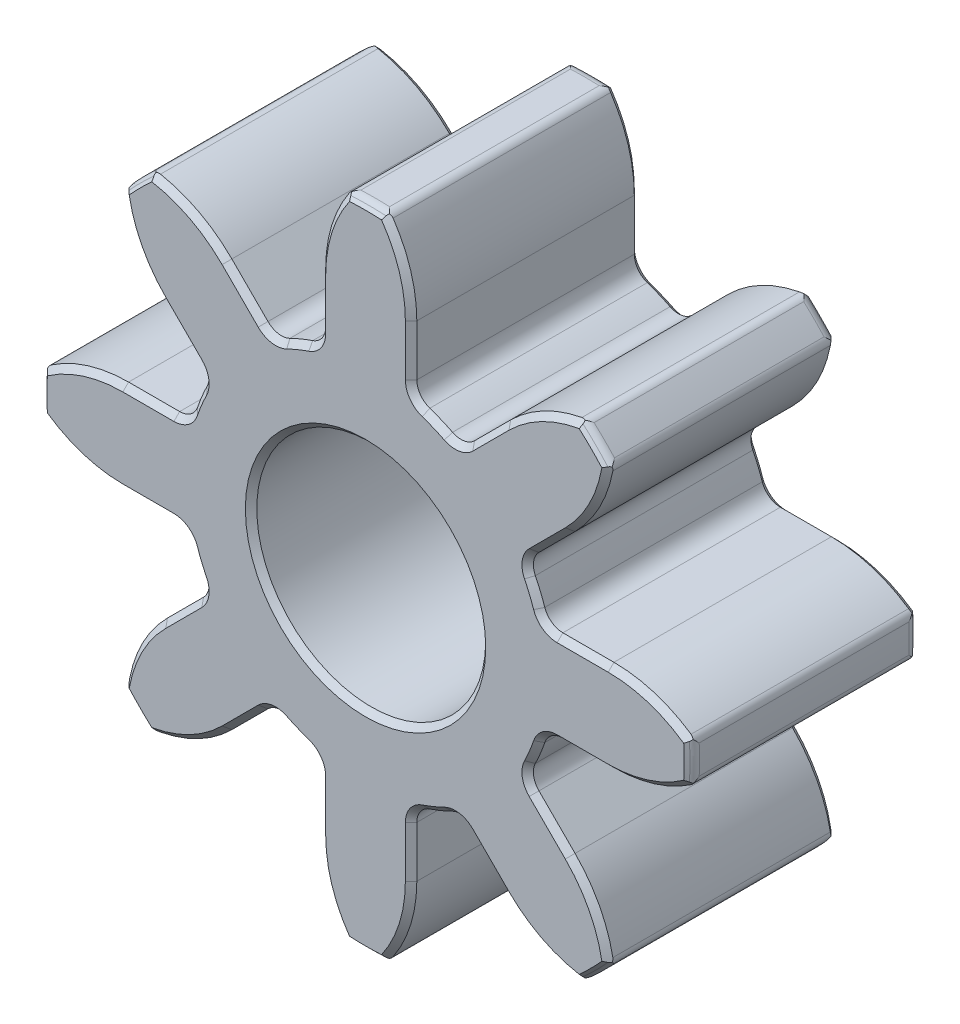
SolidWorks part; units mm, degrees
ref_plane "Спереди" through (0, 0, 0) normal (0, 0, 1) x (1, 0, 0)
ref_plane "Сверху" through (0, 0, 0) normal (0, 1, 0) x (1, 0, 0)
ref_plane "Справа" through (0, 0, 0) normal (1, 0, 0) x (0, 0, -1)
sketch "Эскиз1" plane through (0, 0, 0) normal (0, 0, 1) x (1, 0, 0)
  line L0 (0, 0) -> (0, 8.5) construction
  line L1 (-1.1942, 6.3602) -> (-1.1942, 5.0219)
  line L2 (1.1942, 6.3602) -> (1.1942, 5.0219)
  line L3 (3.6529, 5.3417) -> (2.7067, 4.3954)
  line L4 (5.3417, 3.6529) -> (4.3954, 2.7067)
  line L5 (6.3602, 1.1942) -> (5.0219, 1.1942)
  line L6 (6.3602, -1.1942) -> (5.0219, -1.1942)
  line L7 (5.3417, -3.6529) -> (4.3954, -2.7067)
  line L8 (3.6529, -5.3417) -> (2.7067, -4.3954)
  line L9 (1.1942, -6.3602) -> (1.1942, -5.0219)
  line L10 (-1.1942, -6.3602) -> (-1.1942, -5.0219)
  line L11 (-3.6529, -5.3417) -> (-2.7067, -4.3954)
  line L12 (-5.3417, -3.6529) -> (-4.3954, -2.7067)
  line L13 (-6.3602, -1.1942) -> (-5.0219, -1.1942)
  line L14 (-6.3602, 1.1942) -> (-5.0219, 1.1942)
  line L15 (-5.3417, 3.6529) -> (-4.3954, 2.7067)
  line L16 (-3.6529, 5.3417) -> (-2.7067, 4.3954)
  arc A0 (0.5, 8.4853) -> (-0.5, 8.4853) centre (0, 0) ccw
  circle A1 centre (0, 0) radius 6.8 construction
  arc A2 (-1.5343, 4.5482) -> (-1.8369, 4.4346) centre (0, 0) ccw
  circle A3 centre (0, 0) radius 3
  arc A4 (-0.5, 8.4853) -> (-1.1942, 6.3602) centre (2.4058, 6.3602) ccw
  arc A5 (1.5343, 4.5482) -> (1.8369, 4.4346) centre (0, 0) cw
  arc A6 (1.1942, 5.0219) -> (1.5343, 4.5482) centre (1.6942, 5.0219) ccw
  arc A7 (0.5, 8.4853) -> (1.1942, 6.3602) centre (-2.4058, 6.3602) cw
  arc A8 (2.1311, 4.301) -> (1.8369, 4.4346) centre (0, 0) ccw
  arc A9 (2.7067, 4.3954) -> (2.1311, 4.301) centre (2.3531, 4.749) cw
  arc A10 (5.6464, 6.3536) -> (3.6529, 5.3417) centre (6.1985, 2.7961) ccw
  arc A11 (6.3536, 5.6464) -> (5.6464, 6.3536) centre (0, 0) ccw
  arc A12 (6.3536, 5.6464) -> (5.3417, 3.6529) centre (2.7961, 6.1985) cw
  arc A13 (4.3954, 2.7067) -> (4.301, 2.1311) centre (4.749, 2.3531) ccw
  arc A14 (4.301, 2.1311) -> (4.4346, 1.8369) centre (0, 0) cw
  arc A15 (4.5482, 1.5343) -> (4.4346, 1.8369) centre (0, 0) ccw
  arc A16 (5.0219, 1.1942) -> (4.5482, 1.5343) centre (5.0219, 1.6942) cw
  arc A17 (8.4853, 0.5) -> (6.3602, 1.1942) centre (6.3602, -2.4058) ccw
  arc A18 (8.4853, -0.5) -> (8.4853, 0.5) centre (0, 0) ccw
  arc A19 (8.4853, -0.5) -> (6.3602, -1.1942) centre (6.3602, 2.4058) cw
  arc A20 (5.0219, -1.1942) -> (4.5482, -1.5343) centre (5.0219, -1.6942) ccw
  arc A21 (4.5482, -1.5343) -> (4.4346, -1.8369) centre (0, 0) cw
  arc A22 (4.301, -2.1311) -> (4.4346, -1.8369) centre (0, 0) ccw
  arc A23 (4.3954, -2.7067) -> (4.301, -2.1311) centre (4.749, -2.3531) cw
  arc A24 (6.3536, -5.6464) -> (5.3417, -3.6529) centre (2.7961, -6.1985) ccw
  arc A25 (5.6464, -6.3536) -> (6.3536, -5.6464) centre (0, 0) ccw
  arc A26 (5.6464, -6.3536) -> (3.6529, -5.3417) centre (6.1985, -2.7961) cw
  arc A27 (2.7067, -4.3954) -> (2.1311, -4.301) centre (2.3531, -4.749) ccw
  arc A28 (2.1311, -4.301) -> (1.8369, -4.4346) centre (0, 0) cw
  arc A29 (1.5343, -4.5482) -> (1.8369, -4.4346) centre (0, 0) ccw
  arc A30 (1.1942, -5.0219) -> (1.5343, -4.5482) centre (1.6942, -5.0219) cw
  arc A31 (0.5, -8.4853) -> (1.1942, -6.3602) centre (-2.4058, -6.3602) ccw
  arc A32 (-0.5, -8.4853) -> (0.5, -8.4853) centre (0, 0) ccw
  arc A33 (-0.5, -8.4853) -> (-1.1942, -6.3602) centre (2.4058, -6.3602) cw
  arc A34 (-1.1942, -5.0219) -> (-1.5343, -4.5482) centre (-1.6942, -5.0219) ccw
  arc A35 (-1.5343, -4.5482) -> (-1.8369, -4.4346) centre (0, 0) cw
  arc A36 (-2.1311, -4.301) -> (-1.8369, -4.4346) centre (0, 0) ccw
  arc A37 (-2.7067, -4.3954) -> (-2.1311, -4.301) centre (-2.3531, -4.749) cw
  arc A38 (-5.6464, -6.3536) -> (-3.6529, -5.3417) centre (-6.1985, -2.7961) ccw
  arc A39 (-6.3536, -5.6464) -> (-5.6464, -6.3536) centre (0, 0) ccw
  arc A40 (-6.3536, -5.6464) -> (-5.3417, -3.6529) centre (-2.7961, -6.1985) cw
  arc A41 (-4.3954, -2.7067) -> (-4.301, -2.1311) centre (-4.749, -2.3531) ccw
  arc A42 (-4.301, -2.1311) -> (-4.4346, -1.8369) centre (0, 0) cw
  arc A43 (-4.5482, -1.5343) -> (-4.4346, -1.8369) centre (0, 0) ccw
  arc A44 (-5.0219, -1.1942) -> (-4.5482, -1.5343) centre (-5.0219, -1.6942) cw
  arc A45 (-8.4853, -0.5) -> (-6.3602, -1.1942) centre (-6.3602, 2.4058) ccw
  arc A46 (-8.4853, 0.5) -> (-8.4853, -0.5) centre (0, 0) ccw
  arc A47 (-8.4853, 0.5) -> (-6.3602, 1.1942) centre (-6.3602, -2.4058) cw
  arc A48 (-5.0219, 1.1942) -> (-4.5482, 1.5343) centre (-5.0219, 1.6942) ccw
  arc A49 (-1.1942, 5.0219) -> (-1.5343, 4.5482) centre (-1.6942, 5.0219) cw
  arc A50 (-4.5482, 1.5343) -> (-4.4346, 1.8369) centre (0, 0) cw
  arc A51 (-4.301, 2.1311) -> (-4.4346, 1.8369) centre (0, 0) ccw
  arc A52 (-4.3954, 2.7067) -> (-4.301, 2.1311) centre (-4.749, 2.3531) cw
  arc A53 (-6.3536, 5.6464) -> (-5.3417, 3.6529) centre (-2.7961, 6.1985) ccw
  arc A54 (-5.6464, 6.3536) -> (-6.3536, 5.6464) centre (0, 0) ccw
  arc A55 (-5.6464, 6.3536) -> (-3.6529, 5.3417) centre (-6.1985, 2.7961) cw
  arc A56 (-2.7067, 4.3954) -> (-2.1311, 4.301) centre (-2.3531, 4.749) ccw
  arc A57 (-2.1311, 4.301) -> (-1.8369, 4.4346) centre (0, 0) cw
  dimension "D1" = 17
  dimension "D2" = 6
  dimension "D3" = 9.6
  dimension "D4" = 13.6
  dimension "D6" = 7.2
  dimension "D8" = 8
  dimension "D7" = 0.5
  dimension "D5" = 1
extrude "Бобышка-Вытянуть1" add sketch "Эскиз1" along normal blind 6
chamfer "Фаска1" distance 0.15 angle 45 130 edges at (3, 0, 0) (1.8369, 4.4346, 0) (-1.1942, -5.6911, 0) (-4.8686, -3.1798, 0) (4.2556, -2.4341, 0) (2.4341, -4.2556, 0) (-2.4341, -4.2556, 0) (4.8686, 3.1798, 0) (-5.6911, -1.1942, 0) (0, 8.5, 0) (-1.0162, 7.478, 0) (-1.1942, 5.6911, 0) (-1.288, 4.7303, 0) (-1.8369, 4.4346, 0) (3, 0, 6) (-1.8369, 4.4346, 6) (-1.288, 4.7303, 6) (-1.1942, 5.6911, 6) (-1.0162, 7.478, 6) (0, 8.5, 6) (-5.6911, -1.1942, 6) (4.8686, 3.1798, 6) (-2.4341, -4.2556, 6) (2.4341, -4.2556, 6) (4.2556, -2.4341, 6) (-4.8686, -3.1798, 6) (-1.1942, -5.6911, 6) (1.8369, 4.4346, 6) (-2.4341, 4.2556, 0) (-3.1798, 4.8686, 0) (-4.5692, 6.0063, 0) (-6.0104, 6.0104, 0) (-6.0063, 4.5692, 0) (-4.8686, 3.1798, 0) (-4.2556, 2.4341, 0) (-4.4346, 1.8369, 0) (-4.7303, 1.288, 0) (-5.6911, 1.1942, 0) (-7.478, 1.0162, 0) (-8.5, 0, 0) (-7.478, -1.0162, 0) (-4.7303, -1.288, 0) (-4.4346, -1.8369, 0) (-4.2556, -2.4341, 0) (-6.0063, -4.5692, 0) (-6.0104, -6.0104, 0) (-4.5692, -6.0063, 0) (-3.1798, -4.8686, 0) (-1.8369, -4.4346, 0) (-1.288, -4.7303, 0) (-1.0162, -7.478, 0) (0, -8.5, 0) (1.0162, -7.478, 0) (1.1942, -5.6911, 0) (1.288, -4.7303, 0) (1.8369, -4.4346, 0) (3.1798, -4.8686, 0) (4.5692, -6.0063, 0) (6.0104, -6.0104, 0) (6.0063, -4.5692, 0) (4.8686, -3.1798, 0) (4.4346, -1.8369, 0) (4.7303, -1.288, 0) (5.6911, -1.1942, 0) (7.478, -1.0162, 0) (8.5, 0, 0) (7.478, 1.0162, 0) (5.6911, 1.1942, 0) (4.7303, 1.288, 0) (4.4346, 1.8369, 0) (4.2556, 2.4341, 0) (6.0063, 4.5692, 0) (6.0104, 6.0104, 0) (4.5692, 6.0063, 0) (3.1798, 4.8686, 0) (2.4341, 4.2556, 0) (1.288, 4.7303, 0) (1.1942, 5.6911, 0) (1.0162, 7.478, 0) (1.0162, 7.478, 6) (1.1942, 5.6911, 6) (1.288, 4.7303, 6) (2.4341, 4.2556, 6) (3.1798, 4.8686, 6) (4.5692, 6.0063, 6) (6.0104, 6.0104, 6) (6.0063, 4.5692, 6) (4.2556, 2.4341, 6) (4.4346, 1.8369, 6) (4.7303, 1.288, 6) (5.6911, 1.1942, 6) (7.478, 1.0162, 6) (8.5, 0, 6) (7.478, -1.0162, 6) (5.6911, -1.1942, 6) (4.7303, -1.288, 6) (4.4346, -1.8369, 6) (4.8686, -3.1798, 6) (6.0063, -4.5692, 6) (6.0104, -6.0104, 6) (4.5692, -6.0063, 6) (3.1798, -4.8686, 6) (1.8369, -4.4346, 6) (1.288, -4.7303, 6) (1.1942, -5.6911, 6) (1.0162, -7.478, 6) (0, -8.5, 6) (-1.0162, -7.478, 6) (-1.288, -4.7303, 6) (-1.8369, -4.4346, 6) (-3.1798, -4.8686, 6) (-4.5692, -6.0063, 6) (-6.0104, -6.0104, 6) (-6.0063, -4.5692, 6) (-4.2556, -2.4341, 6) (-4.4346, -1.8369, 6) (-4.7303, -1.288, 6) (-7.478, -1.0162, 6) (-8.5, 0, 6) (-7.478, 1.0162, 6) (-5.6911, 1.1942, 6) (-4.7303, 1.288, 6) (-4.4346, 1.8369, 6) (-4.2556, 2.4341, 6) (-4.8686, 3.1798, 6) (-6.0063, 4.5692, 6) (-6.0104, 6.0104, 6) (-4.5692, 6.0063, 6) (-3.1798, 4.8686, 6) (-2.4341, 4.2556, 6)
fillet "Скругление1" radius 0.25 32 edges at (0, 8.5, 5.85) (-0.5, 8.4853, 3) (0, 8.5, 0.15) (0.5, 8.4853, 3) (-8.5, 0, 5.85) (-8.4853, -0.5, 3) (-8.5, 0, 0.15) (-8.4853, 0.5, 3) (-6.0104, -6.0104, 5.85) (-5.6464, -6.3536, 3) (-6.0104, -6.0104, 0.15) (-6.3536, -5.6464, 3) (0, -8.5, 5.85) (0.5, -8.4853, 3) (0, -8.5, 0.15) (-0.5, -8.4853, 3) (6.0104, -6.0104, 5.85) (6.3536, -5.6464, 3) (6.0104, -6.0104, 0.15) (5.6464, -6.3536, 3) (-6.0104, 6.0104, 5.85) (-6.3536, 5.6464, 3) (-6.0104, 6.0104, 0.15) (-5.6464, 6.3536, 3) (8.5, 0, 5.85) (8.4853, 0.5, 3) (8.5, 0, 0.15) (8.4853, -0.5, 3) (6.0104, 6.0104, 5.85) (5.6464, 6.3536, 3) (6.0104, 6.0104, 0.15) (6.3536, 5.6464, 3)
